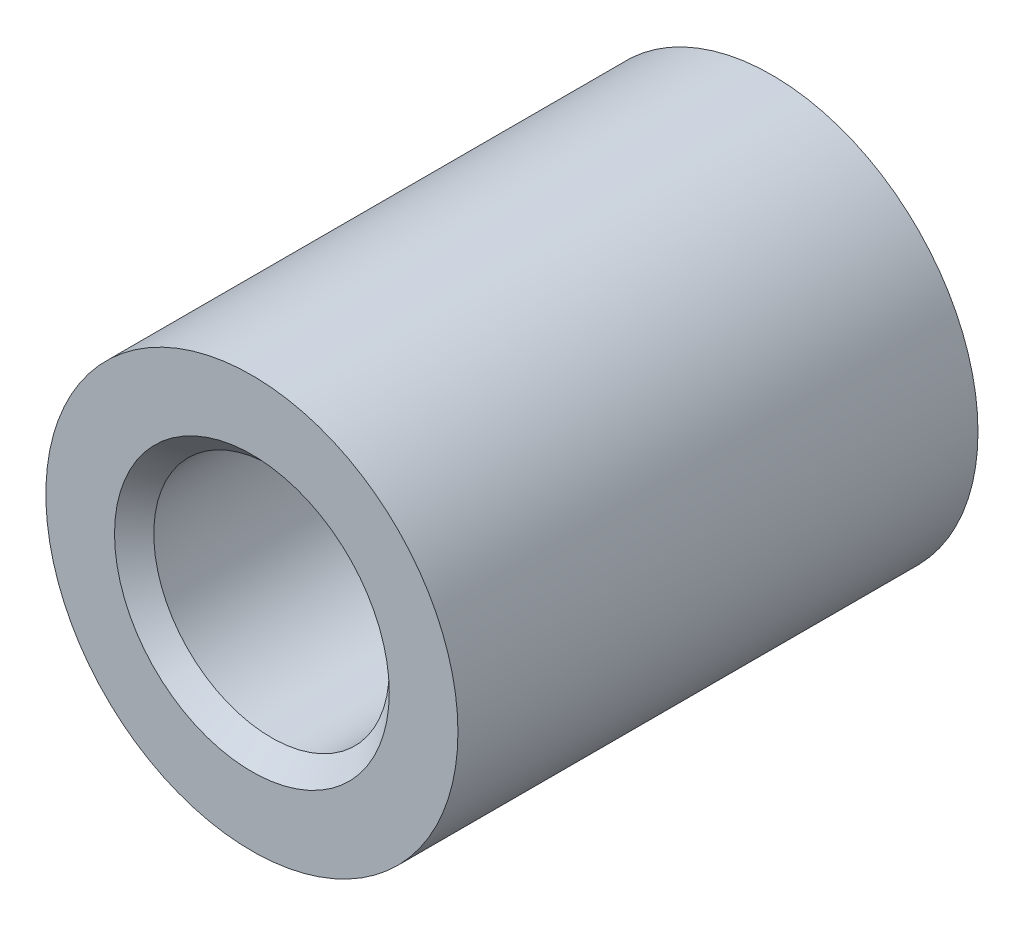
SolidWorks part; units mm, degrees
ref_plane "face" through (0, 0, 0) normal (0, 0, 1) x (1, 0, 0)
ref_plane "dessus" through (0, 0, 0) normal (0, 1, 0) x (1, 0, 0)
ref_plane "profil" through (0, 0, 0) normal (1, 0, 0) x (0, 0, -1)
sketch "Esquisse1" plane through (0, 0, 0) normal (0, 0, 1) x (1, 0, 0)
  circle A0 centre (0, 0) radius 10.5
  circle A1 centre (0, 0) radius 6
  dimension "D1" = 12
  dimension "D2" = 21
extrude "Base-Extrusion" add sketch "Esquisse1" along normal blind 26.5
chamfer "Chanfrein1" distance 1 angle 45 1 edges at (6, 0, 26.5)
sketch "Esq_WRNL_Compact001" plane through (0, 0, 0) normal (0, 0, 1) x (1, 0, 0)
  line L0 (-11.5, -11.5) -> (-11.5, 11.5)
  line L1 (11.5, -11.5) -> (11.5, 11.5)
  line L2 (-11.5, -11.5) -> (11.5, -11.5)
  line L3 (-11.5, 11.5) -> (11.5, 11.5)
